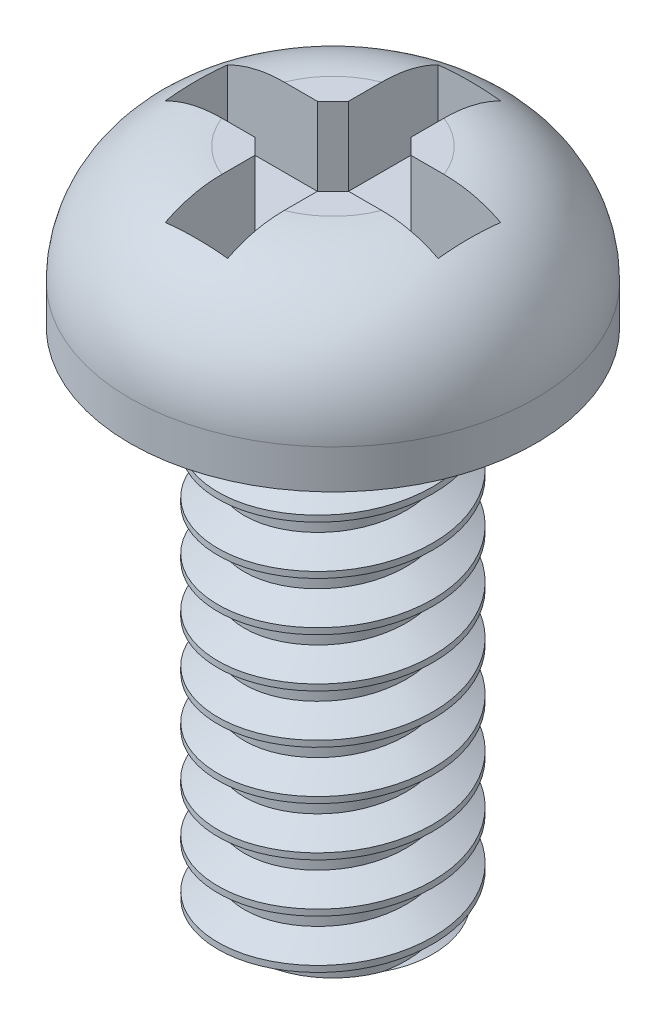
SolidWorks part; units mm, degrees
ref_plane "Front Plane" through (0, 0, 0) normal (0, 0, 1) x (1, 0, 0)
ref_plane "Top Plane" through (0, 0, 0) normal (0, 1, 0) x (1, 0, 0)
ref_plane "Right Plane" through (0, 0, 0) normal (1, 0, 0) x (0, 0, -1)
sketch "Sketch1" plane through (0, 0, 0) normal (0, 1, 0) x (1, 0, 0)
  circle A0 centre (0, 0) radius 1.7526
extrude "Boss-Extrude1" add sketch "Sketch1" along normal blind 8.255
sketch "Sketch2" plane through (0, 8.255, 0) normal (0, 1, 0) x (1, 0, 0)
  circle A0 centre (0, 0) radius 3.302
extrude "Boss-Extrude2" add sketch "Sketch2" along normal blind 2.54
sketch "Sketch3" plane through (0, 10.795, 0) normal (0, 1, 0) x (1, 0, 0)
  line L0 (0.762, 0.508) -> (2.2225, 0.508)
  line L1 (-0.508, -2.2225) -> (0.508, -2.2225)
  line L2 (-0.508, -2.2225) -> (-0.508, -0.762)
  line L3 (-0.508, 2.2225) -> (0.508, 2.2225)
  line L4 (0.508, -2.2225) -> (0.508, -0.762)
  line L5 (-0.508, 0.762) -> (-0.508, 2.2225)
  line L6 (0.762, -0.508) -> (2.2225, -0.508)
  line L7 (-2.2225, 0.508) -> (-0.762, 0.508)
  line L8 (-2.2225, 0.508) -> (-2.2225, -0.508)
  line L9 (-2.2225, -0.508) -> (-0.762, -0.508)
  line L10 (2.2225, 0.508) -> (2.2225, -0.508)
  line L11 (0.508, 0.762) -> (0.508, 2.2225)
  line L12 (-0.762, 0.508) -> (-0.508, 0.762)
  line L13 (0.508, 0.762) -> (0.762, 0.508)
  line L14 (0.508, -0.762) -> (0.762, -0.508)
  line L15 (-0.508, -0.762) -> (-0.762, -0.508)
  point P0 (-0.508, 0.508)
  point P5 (0.508, -0.508)
  point P6 (0, 0)
  point P13 (0.508, 0.508)
  point P14 (-0.508, -0.508)
extrude "Cut-Extrude1" cut sketch "Sketch3" against normal blind 1.27
fillet "Fillet1" radius 1.905 1 edges at (0, 10.795, 3.302)
thread "Thread1" pitch 0.7937 start angle 0, offset 1, length 8.382, pitch 0.7937, diameter 3.5052
ref_plane "Plane1" through (1.7526, -1, 0) normal (0, 0, 1) x (1, 0, 0)
sketch "Thread Profile1" plane through (1.7526, -1, 0) normal (0, 0, 1) x (1, 0, 0)
  line L0 (0, 0) -> (0, 0.7937) construction
  line L11 (0, 0) -> (0, 0.6945)
  line L12 (0, 0.6945) -> (-0.4296, 0.4465)
  line L13 (-0.4296, 0.4465) -> (-0.4296, 0.248)
  line L15 (-0.4296, 0.248) -> (0, 0)
  line L17 (-0.4296, 0.3473) -> (0, 0.3473) construction
  point P2 (0, 0)
  dimension "Pitch" = 0.7937
  dimension "Profile_Angle" = 60
  dimension "Profile_Land" = 0.1984
  dimension "Profile_Height" = 0.4296
